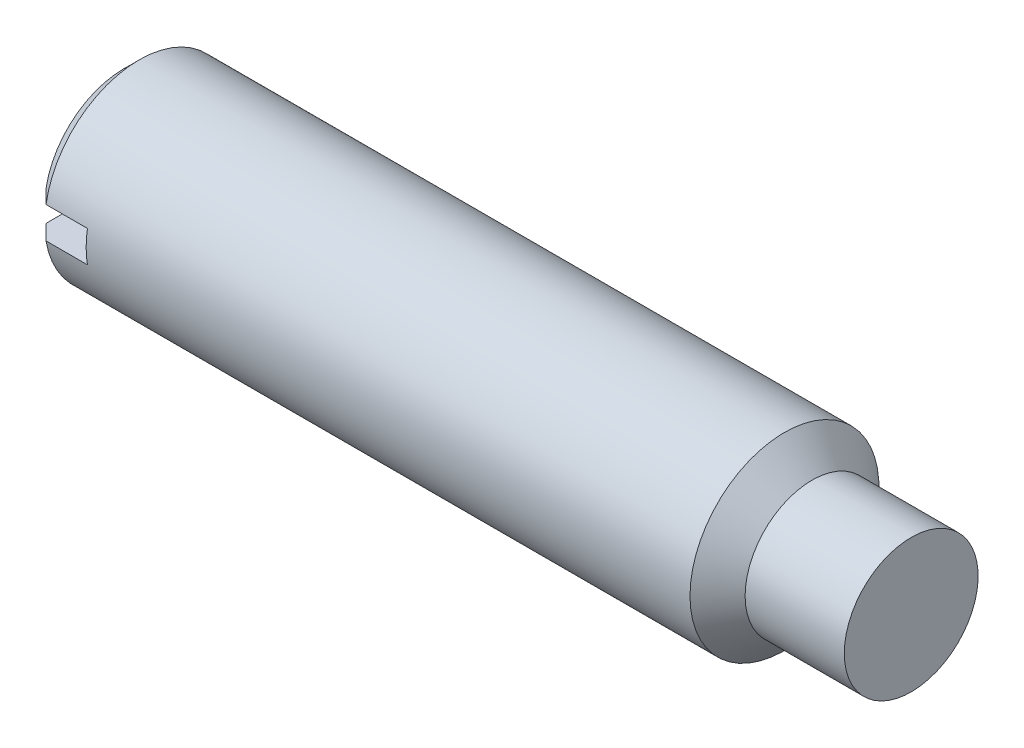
SolidWorks part; units mm, degrees
ref_plane "Front Plane" through (0, 0, 0) normal (0, 0, 1) x (1, 0, 0)
ref_plane "Top Plane" through (0, 0, 0) normal (0, 1, 0) x (1, 0, 0)
ref_plane "Right Plane" through (0, 0, 0) normal (1, 0, 0) x (0, 0, -1)
sketch "BodySke" plane through (0, 0, 0) normal (0, 0, 1) x (1, 0, 0)
  line L0 (0, 0) -> (88.3411, 0) construction
  line L1 (0, 0) -> (0, 5.036)
  line L2 (0, 5.036) -> (0.964, 6)
  line L3 (0.964, 6) -> (41.95, 6)
  line L4 (43.7, 4.25) -> (41.95, 6)
  line L5 (43.7, 4.25) -> (50, 4.25)
  line L6 (50, 0) -> (0, 0)
  line L7 (1.75, 0) -> (1.75, 8.5388) construction
  line L8 (50, 4.25) -> (50, 0)
  line L9 (0, -5.036) -> (0.964, -6) construction
  dimension "Diameter" = 12
  dimension "Thread_minor" = 10.072
  dimension "Length" = 50
  dimension "Dog_dia" = 8.5
  dimension "Nose_chamfer_angle" = 45
  dimension "Drive_chamfer_angle" = 90
  dimension "Advance" = 1.75
  dimension "Dog_length" = 6.3
revolve "BaseBody" add sketch "BodySke" angle 360 about L0
sketch "SlotSke" plane through (0, 0, 0) normal (1, 0, 0) x (0, 0, -1)
  line L0 (-6, 1) -> (6, -1) construction
  line L1 (-6, 1) -> (6, 1)
  line L2 (-6, 1) -> (-6, -1)
  line L3 (-6, -1) -> (6, -1)
  line L4 (6, 1) -> (6, -1)
  dimension "D1" = 12
  dimension "Slot_width" = 2
extrude "Slot" cut sketch "SlotSke" along normal blind 3.6
sketch "ThdSchSke" plane through (0, 0, 0) normal (0, 0, 1) x (1, 0, 0)
  line L0 (0, 0) -> (53.6961, 0) construction
  line L1 (1.6009, 7.1131) -> (1.6009, 6)
  line L2 (1.6009, 7.1131) -> (2.714, 7.1131)
  line L3 (2.714, 7.1131) -> (2.714, 6)
  line L4 (2.714, 6) -> (2.1574, 5.036)
  line L5 (2.1574, 5.036) -> (1.6009, 6)
  dimension "D1" = 1.75
revolve "ThreadSchematic" [suppressed] cut sketch "ThdSchSke" angle 360 about L0
pattern_linear "ThdSchPat" [suppressed]
equation "\"Thread_minor@ThreadCosmetic\" = \"Thread_minor@BodySke\""
equation "\"D1@SlotSke\" = \"Diameter@BodySke\""
equation "\"D1@ThdSchSke\" = \"Advance@BodySke\""
equation "\"Advance@ThdSchPat\" = \"Advance@BodySke\""
equation "\"Tooth_Num@ThdSchPat\" =  int( \"Length@BodySke\" / \"Advance@BodySke\" )  - 1"
